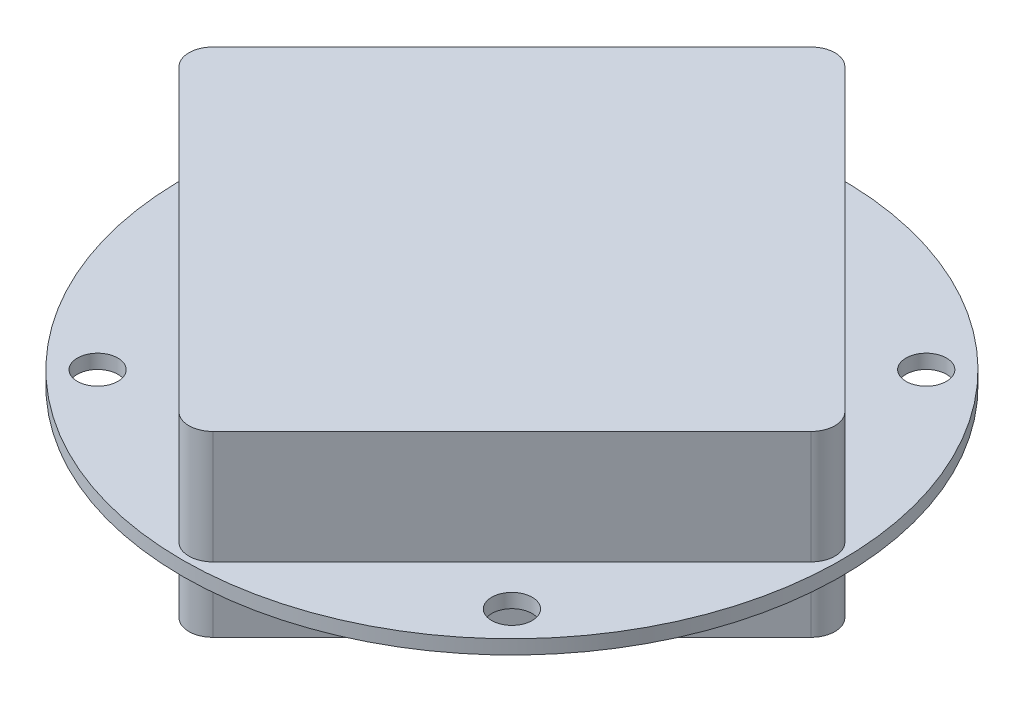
SolidWorks part; units mm, degrees
ref_plane "Front Plane" through (0, 0, 0) normal (0, 0, 1) x (1, 0, 0)
ref_plane "Top Plane" through (0, 0, 0) normal (0, 1, 0) x (1, 0, 0)
ref_plane "Right Plane" through (0, 0, 0) normal (1, 0, 0) x (0, 0, -1)
sketch "Sketch1" plane through (0, 0, 0) normal (0, 1, 0) x (1, 0, 0)
  circle A0 centre (0, 0) radius 17.5
  dimension "D1" = 35
extrude "Boss-Extrude1" add sketch "Sketch1" along normal blind 0.75
sketch "Sketch2" plane through (0, 0.75, 0) normal (0, 1, 0) x (1, 0, 0)
  line L0 (-16.7796, 0.898) -> (-0.898, 16.7796)
  line L1 (-16.7796, -0.898) -> (-0.898, -16.7796)
  line L2 (0.898, 16.7796) -> (16.7796, 0.898)
  line L3 (0.898, -16.7796) -> (16.7796, -0.898)
  line L4 (-17.6777, 0) -> (17.6777, 0) construction
  line L5 (0, 17.6777) -> (0, -17.6777) construction
  arc A0 (-16.7796, -0.898) -> (-16.7796, 0.898) centre (-15.8816, 0) cw
  arc A1 (-0.898, -16.7796) -> (0.898, -16.7796) centre (0, -15.8816) ccw
  arc A2 (16.7796, 0.898) -> (16.7796, -0.898) centre (15.8816, 0) cw
  arc A3 (-0.898, 16.7796) -> (0.898, 16.7796) centre (0, 15.8816) cw
  point P1 (0, 0)
  dimension "D3" = 1.27
  dimension "D1" = 25
  dimension "D2" = 25
extrude "Boss-Extrude2" add sketch "Sketch2" along normal blind 6
sketch "Sketch3" plane through (0, 0, 0) normal (0, -1, 0) x (1, 0, 0)
  line L18 (16.7796, -0.898) -> (0.898, -16.7796)
  line L19 (-0.898, -16.7796) -> (-16.7796, -0.898)
  line L20 (-16.7796, 0.898) -> (-0.898, 16.7796)
  line L21 (16.7796, -0.898) -> (0.898, -16.7796)
  line L22 (-0.898, -16.7796) -> (-16.7796, -0.898)
  line L23 (-16.7796, 0.898) -> (-0.898, 16.7796)
  line L24 (16.7796, 0.898) -> (0.898, 16.7796)
  line L25 (16.7796, 0.898) -> (0.898, 16.7796)
  arc A13 (-16.7796, 0.898) -> (-16.7796, -0.898) centre (-15.8816, 0) ccw
  arc A14 (-0.898, -16.7796) -> (0.898, -16.7796) centre (0, -15.8816) ccw
  arc A15 (-16.7796, 0.898) -> (-16.7796, -0.898) centre (-15.8816, 0) ccw
  arc A16 (-0.898, -16.7796) -> (0.898, -16.7796) centre (0, -15.8816) ccw
  arc A21 (16.7796, -0.898) -> (16.7796, 0.898) centre (15.8816, 0) ccw
  arc A22 (0.898, 16.7796) -> (-0.898, 16.7796) centre (0, 15.8816) ccw
  arc A23 (16.7796, -0.898) -> (16.7796, 0.898) centre (15.8816, 0) ccw
  arc A24 (0.898, 16.7796) -> (-0.898, 16.7796) centre (0, 15.8816) ccw
  dimension "D1" = 0
  dimension "D2" = 0
extrude "Boss-Extrude3" add sketch "Sketch3" along normal blind 2.72
hole_wizard "Ø2.15 (2.15) Diameter Hole1" positions "Sketch5" profile "Sketch4" hole size "Ø2.15" standard "ANSI Metric"
sketch "Sketch5" plane through (0, 0.75, 0) normal (0, 1, 0) x (1, 0, 0)
  line L4 (-11, -11) -> (11, -11)
  line L5 (-11, -11) -> (-11, 11)
  line L6 (-11, 11) -> (11, 11)
  line L7 (11, -11) -> (11, 11)
  line L8 (-11, 0) -> (0, 0) construction
  line L9 (0, 0) -> (0, -11) construction
  point P0 (-11, 11)
  point P2 (11, 11)
  point P4 (11, -11)
  point P6 (-11, -11)
  dimension "D1" = 22
sketch "Sketch4" plane through (-11, 0.75, -11) normal (1, 0, 0) x (0, 0, 1)
  line L0 (0, 0) -> (0, 3.47)
  line L1 (0, 3.47) -> (1.075, 3.47)
  line L2 (1.075, 3.47) -> (1.075, 0)
  line L5 (1.075, 0) -> (0, 0)
  line L11 (0, -6.35) -> (0, 107.95) construction
  dimension "Thru Hole Dia." = 2.15
  dimension "Thru Hole Depth" = 3.47
sketch "Sketch22" plane through (0, 0, 0) normal (0, 0, 1) x (1, 0, 0)
  line L0 (0, -1.35) -> (17.1516, -1.36) construction
  line L1 (22.1487, -6.36) -> (22.1487, -133.36)
  line L5 (0, -2.72) -> (0, 0) construction
  line L6 (17.1516, -2.72) -> (17.1516, 0) construction
  arc A0 (17.1516, -1.36) -> (22.1487, -6.36) centre (17.1487, -6.36) cw
  dimension "D2" = 5
  dimension "D1" = 1.35
  dimension "D4" = 127
ref_plane "Plane12" through (17.1516, 0, 0) normal (1, 0, 0) x (0, 0, -1)
sketch "Sketch23" plane through (17.1516, 0, 0) normal (1, 0, 0) x (0, 0, -1)
  circle A0 centre (0, -1.36) radius 0.69
  dimension "D1" = 1.38
sweep "Sweep6" [suppressed] add profiles "Sketch23" path "Sketch22"
